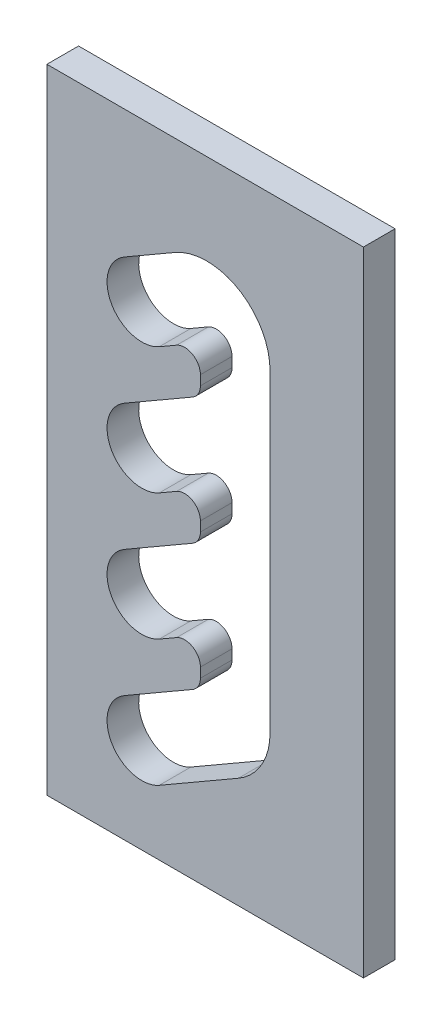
SolidWorks part; units mm, degrees
ref_plane "Ebene vorne" through (0, 0, 0) normal (0, 0, 1) x (1, 0, 0)
ref_plane "Ebene oben" through (0, 0, 0) normal (0, 1, 0) x (1, 0, 0)
ref_plane "Ebene rechts" through (0, 0, 0) normal (1, 0, 0) x (0, 0, -1)
sketch "Skizze1" plane through (0, 0, 0) normal (0, 0, 1) x (1, 0, 0)
  line L1 (0, 0) -> (100, 0)
  line L2 (0, 0) -> (0, 200)
  line L3 (0, 200) -> (100, 200)
  line L4 (100, 0) -> (100, 200)
  dimension "D1" = 100
  dimension "D2" = 200
extrude "Aufsatz-Linear austragen1" add sketch "Skizze1" along normal blind 10
sketch "Skizze2" plane through (0, 0, 10) normal (0, 0, 1) x (1, 0, 0)
  line L0 (30, 30) -> (42.9904, 37.5) construction
  line L3 (24.5, 39.5263) -> (48.4904, 53.3771)
  line L4 (35.5, 20.4737) -> (48.4904, 27.9737)
  line L5 (0, 0) -> (100, 0) construction
  line L6 (0, 200) -> (0, 0) construction
  line L7 (24.5, 79.5263) -> (48.4904, 93.3771)
  line L8 (35.5, 60.4737) -> (48.4904, 67.9737)
  line L9 (24.5, 119.5263) -> (48.4904, 133.3771)
  line L10 (35.5, 100.4737) -> (48.4904, 107.9737)
  line L11 (24.5, 159.5263) -> (48.4904, 173.3771)
  line L12 (35.5, 140.4737) -> (48.4904, 147.9737)
  line L13 (48.4904, 67.9737) -> (48.4904, 53.3771)
  line L14 (48.4904, 107.9737) -> (48.4904, 93.3771)
  line L15 (48.4904, 147.9737) -> (48.4904, 133.3771)
  line L16 (48.4904, 173.3771) -> (70.4904, 186.0788)
  line L17 (70.4904, 186.0788) -> (70.4904, 40.6754)
  line L18 (48.4904, 27.9737) -> (70.4904, 40.6754)
  arc A2 (24.5, 39.5263) -> (35.5, 20.4737) centre (30, 30) ccw
  arc A4 (24.5, 79.5263) -> (35.5, 60.4737) centre (30, 70) ccw
  arc A5 (24.5, 119.5263) -> (35.5, 100.4737) centre (30, 110) ccw
  arc A6 (24.5, 159.5263) -> (35.5, 140.4737) centre (30, 150) ccw
  point P2 (36.4952, 33.75)
  point P15 (48.4904, 173.2863)
  dimension "D1" = 22
  dimension "D2" = 30
  dimension "D3" = 30
  dimension "D4" = 30
  dimension "D5" = 15
  dimension "D6" = 30
  dimension "D7" = 15
  dimension "D9" = 40
  dimension "D10" = 22
  dimension "D8" = 4
extrude "Schnitt-Linear austragen1" cut sketch "Skizze2" against normal through all
fillet "Verrundung1" radius 5 6 edges at (48.4904, 53.3771, 5) (48.4904, 67.9737, 5) (48.4904, 93.3771, 5) (48.4904, 107.9737, 5) (48.4904, 133.3771, 5) (48.4904, 147.9737, 5)
fillet "Verrundung2" radius 20 2 edges at (70.4904, 40.6754, 5) (70.4904, 186.0788, 5)
sketch "Skizze4" plane through (0, 0, 10) normal (0, 0, 1) x (1, 0, 0)
  line L184 (60.4904, 52.2224) -> (60.4904, 151.4378)
  line L185 (45.4904, 160.0981) -> (29.5, 150.866)
  line L186 (30.5, 149.134) -> (35.9904, 152.3038)
  line L187 (58.4904, 139.3135) -> (58.4904, 136.2639)
  line L188 (50.9904, 123.2735) -> (29.5, 110.866)
  line L189 (30.5, 109.134) -> (35.9904, 112.3038)
  line L190 (58.4904, 99.3135) -> (58.4904, 96.2639)
  line L191 (50.9904, 83.2735) -> (29.5, 70.866)
  line L192 (30.5, 69.134) -> (35.9904, 72.3038)
  line L193 (58.4904, 59.3135) -> (58.4904, 56.2639)
  line L194 (50.9904, 43.2735) -> (29.5, 30.866)
  line L195 (30.5, 29.134) -> (55.4904, 43.5622)
  line L196 (60.4904, 52.2224) -> (60.4904, 151.4378)
  line L197 (45.4904, 160.0981) -> (29.5, 150.866)
  line L198 (30.5, 149.134) -> (35.9904, 152.3038)
  line L199 (58.4904, 139.3135) -> (58.4904, 136.2639)
  line L200 (50.9904, 123.2735) -> (29.5, 110.866)
  line L201 (30.5, 109.134) -> (35.9904, 112.3038)
  line L202 (58.4904, 99.3135) -> (58.4904, 96.2639)
  line L203 (50.9904, 83.2735) -> (29.5, 70.866)
  line L204 (30.5, 69.134) -> (35.9904, 72.3038)
  line L205 (58.4904, 59.3135) -> (58.4904, 56.2639)
  line L206 (50.9904, 43.2735) -> (29.5, 30.866)
  line L207 (30.5, 29.134) -> (55.4904, 43.5622)
  arc A168 (55.4904, 43.5622) -> (60.4904, 52.2224) centre (50.4904, 52.2224) ccw
  arc A169 (60.4904, 151.4378) -> (45.4904, 160.0981) centre (50.4904, 151.4378) ccw
  arc A170 (29.5, 150.866) -> (30.5, 149.134) centre (30, 150) ccw
  arc A171 (58.4904, 139.3135) -> (35.9904, 152.3038) centre (43.4904, 139.3135) ccw
  arc A172 (50.9904, 123.2735) -> (58.4904, 136.2639) centre (43.4904, 136.2639) ccw
  arc A173 (29.5, 110.866) -> (30.5, 109.134) centre (30, 110) ccw
  arc A174 (58.4904, 99.3135) -> (35.9904, 112.3038) centre (43.4904, 99.3135) ccw
  arc A175 (50.9904, 83.2735) -> (58.4904, 96.2639) centre (43.4904, 96.2639) ccw
  arc A176 (29.5, 70.866) -> (30.5, 69.134) centre (30, 70) ccw
  arc A177 (58.4904, 59.3135) -> (35.9904, 72.3038) centre (43.4904, 59.3135) ccw
  arc A178 (50.9904, 43.2735) -> (58.4904, 56.2639) centre (43.4904, 56.2639) ccw
  arc A179 (29.5, 30.866) -> (30.5, 29.134) centre (30, 30) ccw
  arc A180 (55.4904, 43.5622) -> (60.4904, 52.2224) centre (50.4904, 52.2224) ccw
  arc A181 (60.4904, 151.4378) -> (45.4904, 160.0981) centre (50.4904, 151.4378) ccw
  arc A182 (29.5, 150.866) -> (30.5, 149.134) centre (30, 150) ccw
  arc A183 (58.4904, 139.3135) -> (35.9904, 152.3038) centre (43.4904, 139.3135) ccw
  arc A184 (50.9904, 123.2735) -> (58.4904, 136.2639) centre (43.4904, 136.2639) ccw
  arc A185 (29.5, 110.866) -> (30.5, 109.134) centre (30, 110) ccw
  arc A186 (58.4904, 99.3135) -> (35.9904, 112.3038) centre (43.4904, 99.3135) ccw
  arc A187 (50.9904, 83.2735) -> (58.4904, 96.2639) centre (43.4904, 96.2639) ccw
  arc A188 (29.5, 70.866) -> (30.5, 69.134) centre (30, 70) ccw
  arc A189 (58.4904, 59.3135) -> (35.9904, 72.3038) centre (43.4904, 59.3135) ccw
  arc A190 (50.9904, 43.2735) -> (58.4904, 56.2639) centre (43.4904, 56.2639) ccw
  arc A191 (29.5, 30.866) -> (30.5, 29.134) centre (30, 30) ccw
  dimension "D1" = 10
